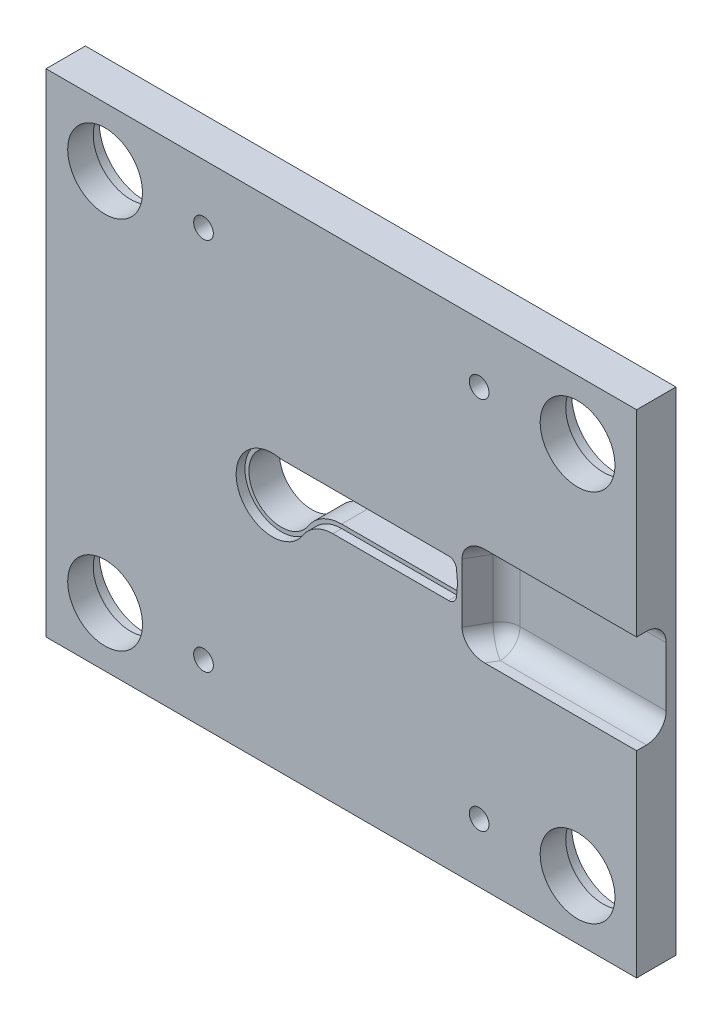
SolidWorks part; units mm, degrees
ref_plane "Plan1" through (0, 0, 0) normal (0, 0, 1) x (1, 0, 0)
ref_plane "Plan2" through (0, 0, 0) normal (0, 1, 0) x (1, 0, 0)
ref_plane "Plan3" through (0, 0, 0) normal (1, 0, 0) x (0, 0, -1)
sketch "Esquisse1" plane through (0, 0, 0) normal (0, 0, 1) x (1, 0, 0)
  line L1 (0, 0) -> (300, 0)
  line L2 (0, 0) -> (0, 250)
  line L3 (0, 250) -> (300, 250)
  line L4 (300, 0) -> (300, 250)
  dimension "D1" = 250
  dimension "D2" = 300
extrude "Base-Extrusion" add sketch "Esquisse1" along normal blind 20
sketch "Esquisse2" plane through (0, 0, 20) normal (0, 0, 1) x (1, 0, 0)
  line L0 (-10, 120) -> (90, 120) construction
  line L1 (0, 0) -> (300, 0) construction
  line L2 (20.3045, 128.12) -> (209.4484, 128.12) construction
  line L3 (121.0782, 135.935) -> (204.4898, 135.935)
  line L4 (206.5121, 134.0819) -> (207.0337, 128.12)
  line L5 (206.5121, 122.1581) -> (207.0337, 128.12)
  line L6 (145.6814, 120.305) -> (204.4898, 120.305)
  line L7 (300, 0) -> (300, 250) construction
  arc A0 (117.7404, 136.2151) -> (128.8329, 111.1069) centre (115, 120) ccw
  arc A1 (204.4898, 135.935) -> (206.5121, 134.0819) centre (204.4898, 133.905) cw
  arc A2 (121.0782, 135.935) -> (117.7404, 136.2151) centre (121.0782, 155.965) cw
  arc A3 (204.4898, 120.305) -> (206.5121, 122.1581) centre (204.4898, 122.335) ccw
  arc A4 (145.6814, 120.305) -> (128.8329, 111.1069) centre (145.6814, 100.275) ccw
  point P13 (206.35, 135.935)
  dimension "D2" = 32.89
  dimension "D6" = 91.35
  dimension "D7" = 2.03
  dimension "D8" = 20.03
  dimension "D9" = 20.03
  dimension "D10" = 185
  dimension "D1" = 120
  dimension "D3" = 8.12
  dimension "D4" = 7.815
  dimension "D5" = 95
  dimension "D11" = 27.845
extrude "Enlèv. mat.-Extru.1" cut sketch "Esquisse2" against normal through all
sketch "Esquisse10" plane through (0, 0, 20) normal (0, 0, 1) x (1, 0, 0)
  line L8 (208.5045, 121.9838) -> (209.0414, 128.12)
  line L9 (145.6814, 118.305) -> (204.4898, 118.305)
  line L10 (209.0414, 128.12) -> (208.5045, 134.2562)
  line L11 (204.4898, 137.935) -> (121.0782, 137.935)
  line L12 (208.5045, 121.9838) -> (209.0414, 128.12)
  line L13 (145.6814, 118.305) -> (204.4898, 118.305)
  line L14 (209.0414, 128.12) -> (208.5045, 134.2562)
  line L15 (204.4898, 137.935) -> (121.0782, 137.935)
  arc A10 (204.4898, 118.305) -> (208.5045, 121.9838) centre (204.4898, 122.335) ccw
  arc A11 (145.6814, 118.305) -> (130.5153, 110.0253) centre (145.6814, 100.275) ccw
  arc A12 (118.0737, 138.1871) -> (130.5153, 110.0253) centre (115, 120) ccw
  arc A13 (118.0737, 138.1871) -> (121.0782, 137.935) centre (121.0782, 155.965) ccw
  arc A14 (208.5045, 134.2562) -> (204.4898, 137.935) centre (204.4898, 133.905) ccw
  arc A15 (204.4898, 118.305) -> (208.5045, 121.9838) centre (204.4898, 122.335) ccw
  arc A16 (145.6814, 118.305) -> (130.5153, 110.0253) centre (145.6814, 100.275) ccw
  arc A17 (118.0737, 138.1871) -> (130.5153, 110.0253) centre (115, 120) ccw
  arc A18 (118.0737, 138.1871) -> (121.0782, 137.935) centre (121.0782, 155.965) ccw
  arc A19 (208.5045, 134.2562) -> (204.4898, 137.935) centre (204.4898, 133.905) ccw
  dimension "D1" = 2
extrude "Enlèv. mat.-Extru.9" cut sketch "Esquisse10" against normal blind 4.5
sketch "Esquisse17" plane through (0, 0, 20) normal (0, 0, 1) x (1, 0, 0)
  line L0 (300, 0) -> (300, 250) construction
  line L1 (300, 150) -> (220, 150)
  line L2 (300, 150) -> (300, 100)
  line L3 (300, 100) -> (220, 100)
  line L4 (220, 150) -> (220, 100)
  line L5 (0, 0) -> (300, 0) construction
  dimension "D1" = 50
  dimension "D2" = 100
  dimension "D3" = 80
extrude "Enlèv. mat.-Extru.11" cut sketch "Esquisse17" against normal blind 15
draft "Dépouille1" type of draft neutral plane draft angle 30 faces to draft 1 parameters "D1"=30
fillet "Congé1" radius 10 5 edges at (260, 100, 5) (220, 125, 5) (215.6699, 100, 12.5) (260, 150, 5) (215.6699, 150, 12.5)
sketch "Esquisse18" plane through (0, 0, 0) normal (0, 0, -1) x (-1, 0, 0)
  line L0 (0, 250) -> (0, 0) construction
  line L1 (-300, 250) -> (0, 250) construction
  line L2 (0, 0) -> (-300, 0) construction
  circle A0 centre (-30, 220) radius 23
  circle A1 centre (-30, 30) radius 23
  circle A2 centre (-270, 30) radius 23
  circle A3 centre (-270, 220) radius 23
  dimension "D1" = 240
  dimension "D2" = 240
  dimension "D3" = 30
  dimension "D4" = 30
  dimension "D5" = 30
  dimension "D6" = 190
  dimension "D7" = 30
  dimension "D8" = 30
  dimension "D9" = 46
  dimension "D10" = 46
  dimension "D11" = 46
  dimension "D12" = 46
extrude "Enlèv. mat.-Extru.12" cut sketch "Esquisse18" against normal blind 7
sketch "Esquisse19" plane through (0, 0, 7) normal (0, 0, -1) x (-1, 0, 0)
  circle A0 centre (-30, 220) radius 19
  circle A1 centre (-30, 30) radius 19
  circle A2 centre (-270, 30) radius 19
  circle A3 centre (-270, 220) radius 19
  dimension "D1" = 38
  dimension "D2" = 38
  dimension "D3" = 38
  dimension "D4" = 38
extrude "Enlèv. mat.-Extru.13" cut sketch "Esquisse19" against normal through all
hole_wizard "Trou taraudé M101" positions "Esquisse21" profile "Esquisse20" tap size "M10" standard "ISO"
sketch "Esquisse21" plane through (0, 0, 0) normal (0, 0, -1) x (-1, 0, 0)
  line L0 (0, 0) -> (-300, 0) construction
  line L1 (-300, 250) -> (0, 250) construction
  circle A0 centre (-270, 220) radius 23 construction
  circle A1 centre (-30, 220) radius 19 construction
  circle A2 centre (-30, 30) radius 19 construction
  circle A4 centre (-270, 30) radius 23 construction
  point P0 (-220, 220)
  point P1 (-80, 220)
  point P2 (-80, 30)
  point P3 (-220, 30)
  dimension "D1" = 50
  dimension "D2" = 50
  dimension "D3" = 50
  dimension "D4" = 50
  dimension "D5" = 30
  dimension "D6" = 30
  dimension "D7" = 30
  dimension "D8" = 30
sketch "Esquisse20" plane through (220, 220, 0) normal (1, 0, 0) x (0, 1, 0)
  line L0 (0, 0) -> (0, 20)
  line L1 (0, 20) -> (5, 20)
  line L2 (5, 20) -> (5, 0)
  line L5 (5, 0) -> (0, 0)
  line L11 (0, -6.35) -> (0, 107.95) construction
  dimension "Diamètre principal du filetage" = 10
  dimension "Profondeur du trou pour taraudage jusqu'au prochain" = 20
